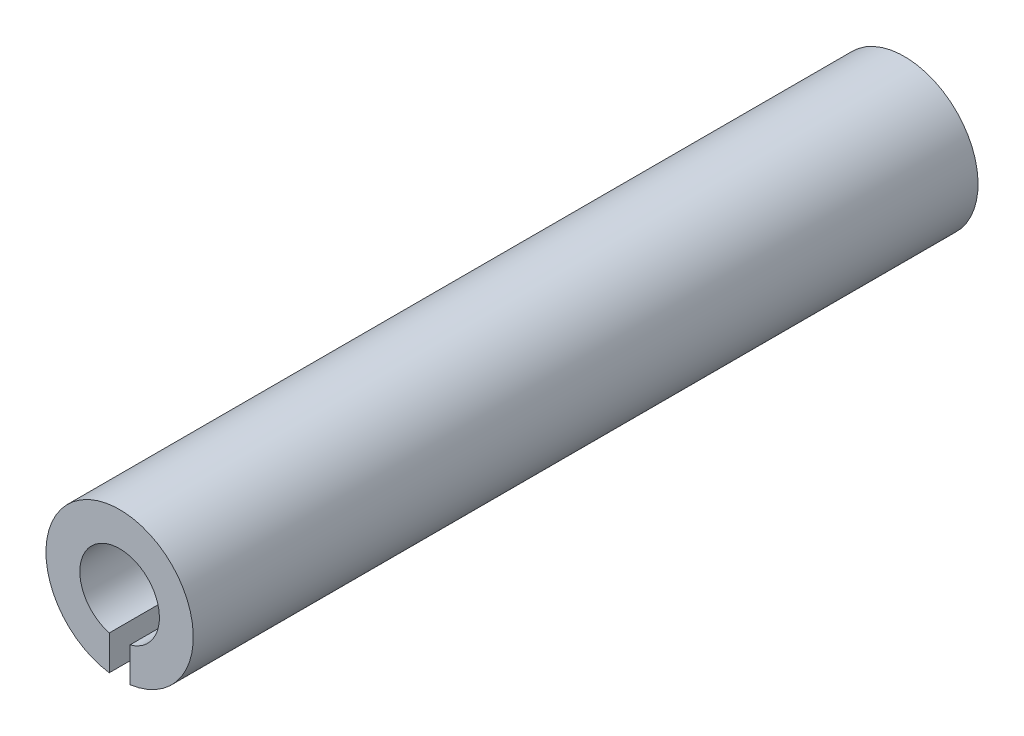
SolidWorks part; units mm, degrees
ref_plane "Front Plane" through (0, 0, 0) normal (0, 0, 1) x (1, 0, 0)
ref_plane "Top Plane" through (0, 0, 0) normal (0, 1, 0) x (1, 0, 0)
ref_plane "Right Plane" through (0, 0, 0) normal (1, 0, 0) x (0, 0, -1)
sketch "Sketch1" plane through (0, 0, 0) normal (0, 0, 1) x (1, 0, 0)
  line L0 (0, -0.2) -> (0, 0) construction
  line L1 (-0.125, -0.2) -> (0.125, -0.2)
  line L2 (-0.125, -0.2) -> (-0.125, -1)
  line L3 (-0.125, -1) -> (0.125, -1)
  line L4 (0.125, -0.2) -> (0.125, -1)
  circle A0 centre (0, 0) radius 0.889
  circle A1 centre (0, 0) radius 0.48
  dimension "D1" = 1.778
  dimension "D2" = 0.96
  dimension "D3" = 0.25
  dimension "D4" = 1
  dimension "D5" = 0.2
extrude "Boss-Extrude1" add sketch "Sketch1" against normal blind 9.47 contours A1 L4 A0 L2
